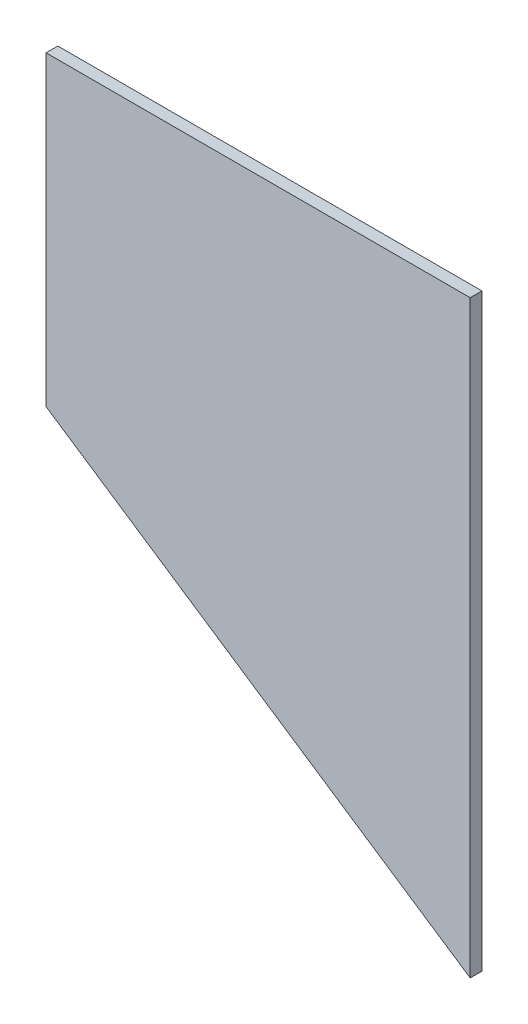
SolidWorks part; units mm, degrees
ref_plane "Front Plane" through (0, 0, 0) normal (1, 0, 0) x (0, 1, 0)
ref_plane "Top Plane" through (0, 0, 0) normal (0, 0, 1) x (0, 1, 0)
ref_plane "Right Plane" through (0, 0, 0) normal (0, 1, 0) x (-1, 0, 0)
sketch "Sketch1" plane through (0, 0, 0) normal (1, 0, 0) x (0, 1, 0)
  line L1 (-82.55, 76.2) -> (82.55, 76.2)
  line L2 (-82.55, 76.2) -> (-82.55, 82.55)
  line L3 (-82.55, 82.55) -> (82.55, 82.55)
  line L4 (82.55, 76.2) -> (82.55, 82.55)
ref_plane "Plane1" through (304.8, 0, 0) normal (1, 0, 0) x (0, 1, 0)
sketch "Sketch2" plane through (304.8, 0, 0) normal (1, 0, 0) x (0, 1, 0)
  line L1 (-158.75, 152.4) -> (158.75, 152.4)
  line L2 (-158.75, 152.4) -> (-158.75, 158.75)
  line L3 (-158.75, 158.75) -> (158.75, 158.75)
  line L4 (158.75, 152.4) -> (158.75, 158.75)
loft "Tapered_plywood_panel" add profiles "Sketch1", "Sketch2"
